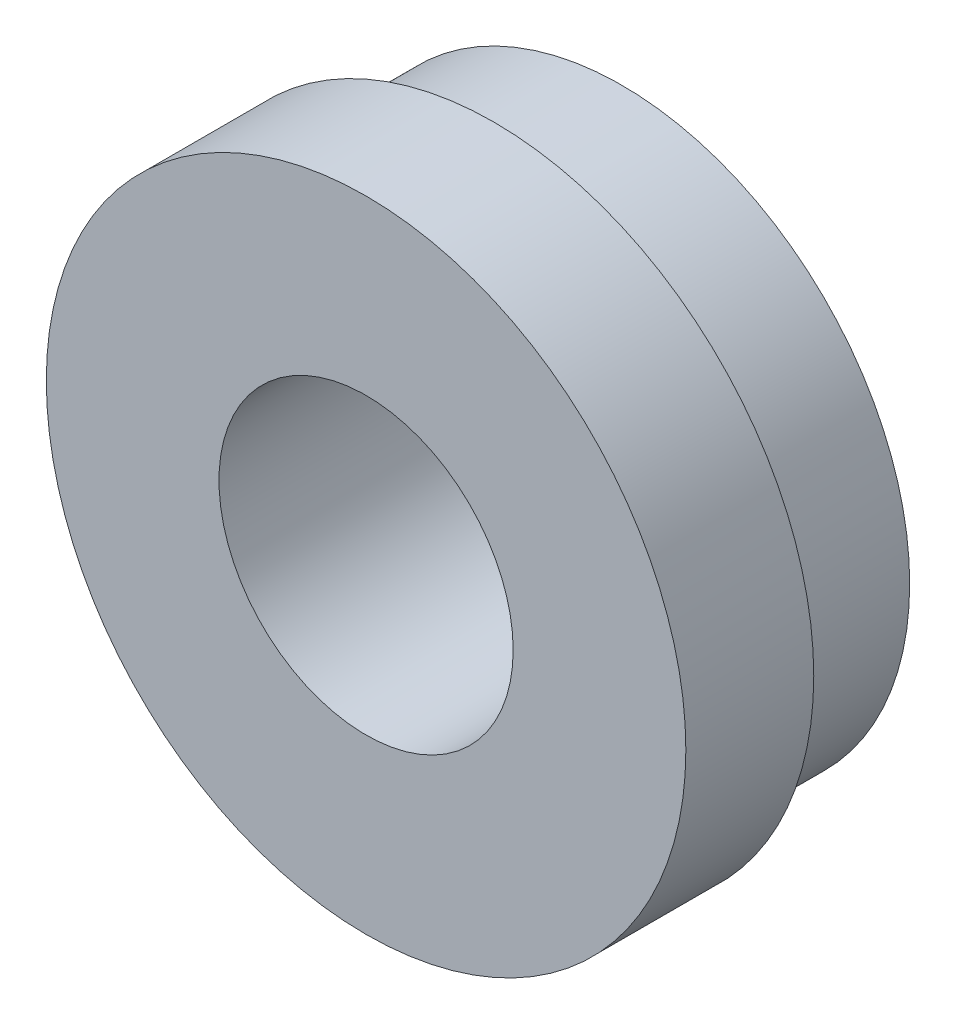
SolidWorks part; units mm, degrees
ref_plane "Plan de face" through (0, 0, 0) normal (0, 0, 1) x (1, 0, 0)
ref_plane "Plan de dessus" through (0, 0, 0) normal (0, 1, 0) x (1, 0, 0)
ref_plane "Plan de droite" through (0, 0, 0) normal (1, 0, 0) x (0, 0, -1)
sketch "Esquisse1" plane through (0, 0, 0) normal (0, 0, 1) x (1, 0, 0)
  circle A0 centre (0, 0) radius 45
extrude "Extrusion1" add sketch "Esquisse1" against normal blind 20
sketch "Esquisse2" plane through (0, 0, 0) normal (0, 0, 1) x (1, 0, 0)
  circle A0 centre (0, 0) radius 50
extrude "Extrusion2" add sketch "Esquisse2" along normal blind 20
sketch "Esquisse3" plane through (0, 0, 20) normal (0, 0, 1) x (1, 0, 0)
  circle A0 centre (0, 0) radius 23
  dimension "D1" = 46
extrude "Enlèv. mat.-Extru.1" cut sketch "Esquisse3" against normal through all
